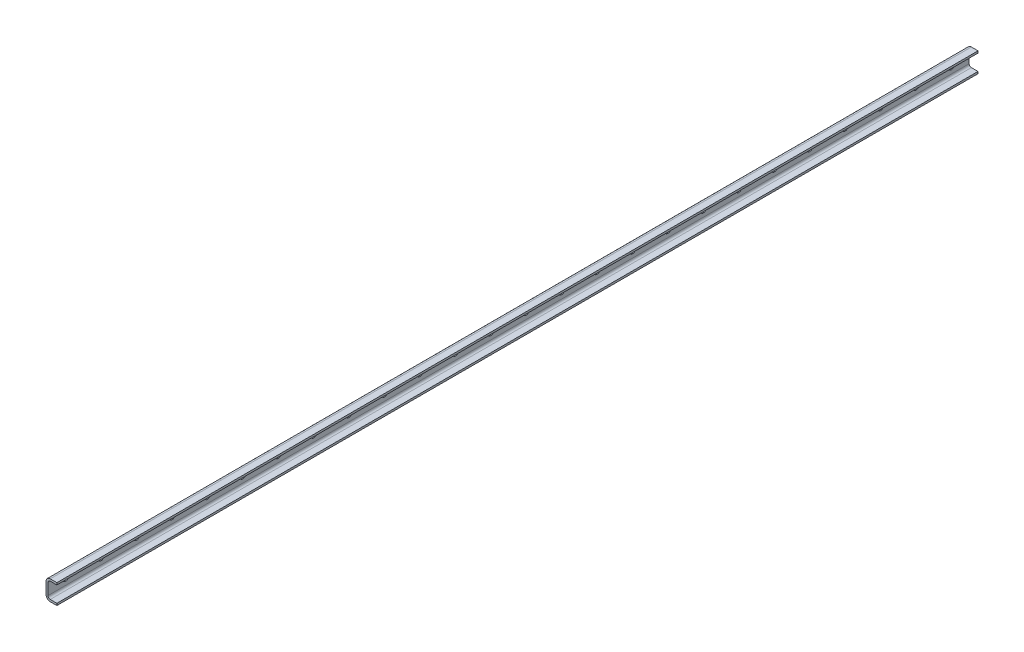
SolidWorks part; units mm, degrees
ref_plane "Front Plane" through (0, 0, 0) normal (0, 0, 1) x (1, 0, 0)
ref_plane "Top Plane" through (0, 0, 0) normal (0, 1, 0) x (1, 0, 0)
ref_plane "Right Plane" through (0, 0, 0) normal (1, 0, 0) x (0, 0, -1)
sketch "Sketch1" plane through (0, 0, 0) normal (0, 0, 1) x (1, 0, 0)
  line L0 (24.5, 17.9) -> (24.5, 22.4)
  line L1 (24.5, 22.4) -> (9.5, 22.4)
  line L2 (0, 12.9) -> (0, -12.9)
  line L3 (9.5, -22.4) -> (24.5, -22.4)
  line L4 (24.5, -22.4) -> (24.5, -17.9)
  line L5 (24.5, -17.9) -> (9.5, -17.9)
  line L6 (4.5, -12.9) -> (4.5, 12.9)
  line L7 (9.5, 17.9) -> (24.5, 17.9)
  arc A0 (9.5, 22.4) -> (0, 12.9) centre (9.5, 12.9) ccw
  arc A1 (0, -12.9) -> (9.5, -22.4) centre (9.5, -12.9) ccw
  arc A2 (9.5, -17.9) -> (4.5, -12.9) centre (9.5, -12.9) cw
  arc A3 (4.5, 12.9) -> (9.5, 17.9) centre (9.5, 12.9) cw
  dimension "D1" = 9.5
  dimension "D2" = 5
  dimension "D3" = 24.5
  dimension "D4" = 17.9
  dimension "D5" = 17.9
extrude "Extrude1" add sketch "Sketch1" against normal blind 2080
sketch "Sketch2" plane through (4.5, 0, 0) normal (1, 0, 0) x (0, 0, -1)
  line L0 (39, 0) -> (41, 0) construction
  line L1 (39, 4.5) -> (41, 4.5)
  line L2 (39, -4.5) -> (41, -4.5)
  arc A0 (39, 4.5) -> (39, -4.5) centre (39, 0) ccw
  arc A1 (41, 4.5) -> (41, -4.5) centre (41, 0) cw
  point P9 (40, 0)
  dimension "D1" = 2
  dimension "D2" = 9
  dimension "D3" = 40
extrude "Extrude2" cut sketch "Sketch2" against normal through all
pattern_linear "LPattern1" count 26 spacing 80 along (0, 0, -1) of "Extrude2"
